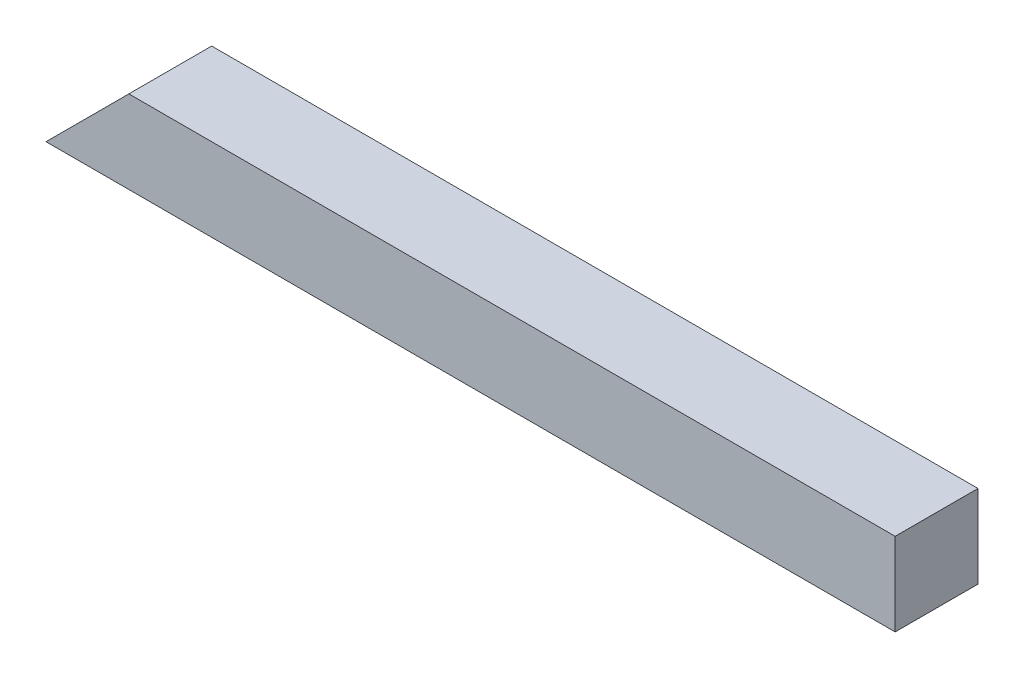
SolidWorks part; units mm, degrees
ref_plane "Plan de face" through (0, 0, 0) normal (0, 0, 1) x (1, 0, 0)
ref_plane "Plan de dessus" through (0, 0, 0) normal (0, 1, 0) x (1, 0, 0)
ref_plane "Plan de droite" through (0, 0, 0) normal (1, 0, 0) x (0, 0, -1)
sketch "Esquisse1" plane through (0, 0, 0) normal (0, 0, 1) x (1, 0, 0)
  line L0 (40, 40) -> (410, 40)
  line L1 (410, 40) -> (410, 0)
  line L2 (410, 0) -> (0, 0)
  line L3 (0, 0) -> (40, 40)
extrude "Boss.-Extru.1" add sketch "Esquisse1" against normal blind 40
